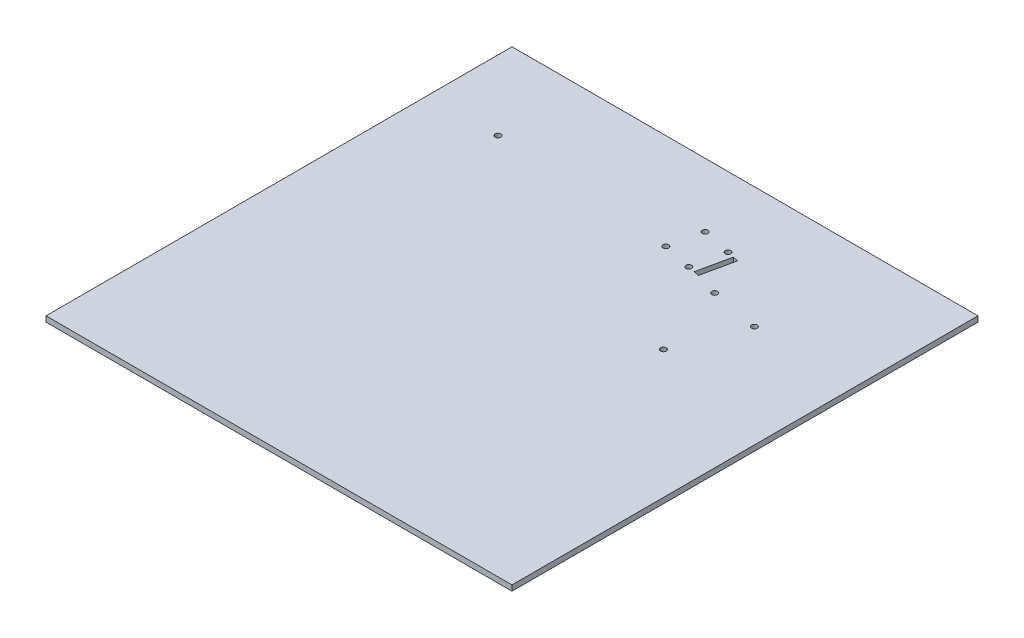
SolidWorks part; units mm, degrees
ref_plane "Front Plane" through (0, 0, 0) normal (0, 0, 1) x (1, 0, 0)
ref_plane "Top Plane" through (0, 0, 0) normal (0, 1, 0) x (1, 0, 0)
ref_plane "Right Plane" through (0, 0, 0) normal (1, 0, 0) x (0, 0, -1)
sketch "Sketch2" plane through (0, 0, 0) normal (0, 1, 0) x (1, 0, 0)
  line L1 (-127, 127) -> (127, 127)
  line L2 (-127, 127) -> (-127, -127)
  line L3 (-127, -127) -> (127, -127)
  line L4 (127, 127) -> (127, -127)
  line L5 (-127, 127) -> (127, -127) construction
  line L6 (-127, -127) -> (127, 127) construction
  line L8 (31.75, 69.85) -> (28.8462, 70.4741)
  line L9 (28.8462, 70.4741) -> (32.6244, 88.0532)
  line L10 (32.6244, 88.0532) -> (35.5282, 87.4291)
  line L11 (35.5282, 87.4291) -> (31.75, 69.85)
  circle A0 centre (57.15, 25.4) radius 1.55
  circle A1 centre (71.12, 60.96) radius 1.55
  circle A2 centre (44.45, 66.04) radius 1.55
  circle A3 centre (9.1886, 74.699) radius 1.55
  circle A4 centre (12.9668, 92.2781) radius 1.55
  circle A5 centre (28.8462, 88.8652) radius 1.55
  circle A6 centre (25.068, 71.2861) radius 1.55
  circle A7 centre (-88.9, 81.28) radius 1.55
  point P0 (0, 0)
extrude "Boss-Extrude1" add sketch "Sketch2" along normal blind 3
